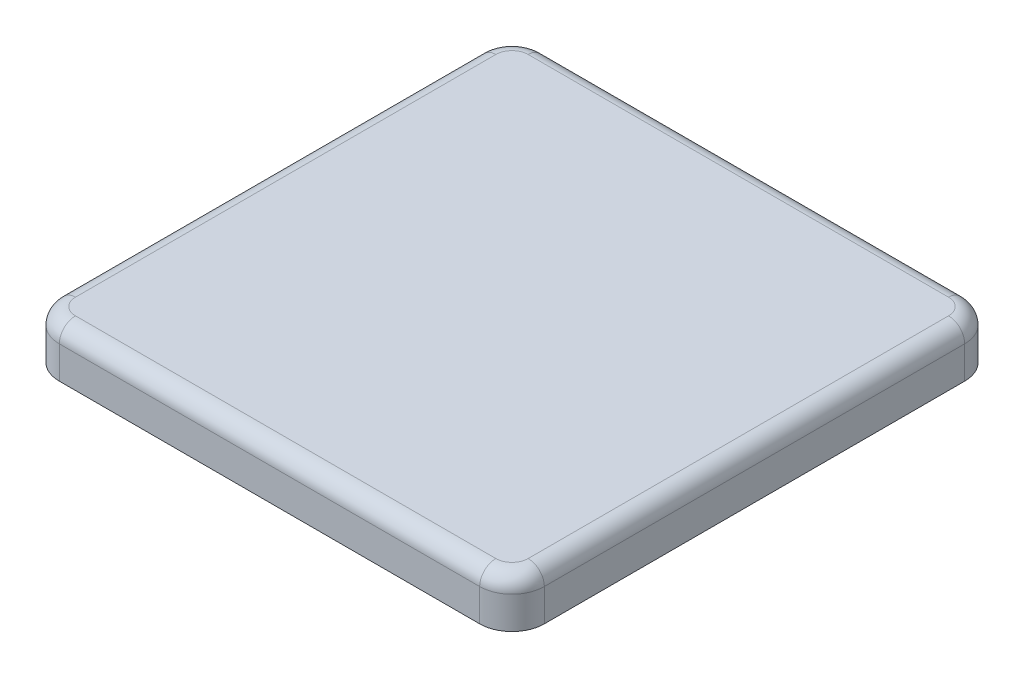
SolidWorks part; units mm, degrees
ref_plane "正面" through (0, 0, 0) normal (0, 0, 1) x (1, 0, 0)
ref_plane "平面" through (0, 0, 0) normal (0, 1, 0) x (1, 0, 0)
ref_plane "右側面" through (0, 0, 0) normal (1, 0, 0) x (0, 0, -1)
sketch "ｽｹｯﾁ1" plane through (0, 0, 0) normal (0, 1, 0) x (0, 0, -1)
  line L1 (-13, 15) -> (13, 15)
  line L2 (-15, 13) -> (-15, -13)
  line L3 (-13, -15) -> (13, -15)
  line L4 (15, 13) -> (15, -13)
  arc A0 (15, 13) -> (13, 15) centre (13, 13) ccw
  arc A1 (13, -15) -> (15, -13) centre (13, -13) ccw
  arc A2 (-15, -13) -> (-13, -15) centre (-13, -13) ccw
  arc A3 (-13, 15) -> (-15, 13) centre (-13, 13) ccw
  point P7 (15, 15)
  point P10 (15, -15)
  point P15 (-15, 15)
  dimension "D5" = 2
  dimension "D1" = 15
  dimension "D2" = 30
  dimension "D3" = 15
  dimension "D4" = 30
extrude "押し出し1" add sketch "ｽｹｯﾁ1" along normal mid plane 3
fillet "ﾌｨﾚｯﾄ1" radius 1 8 edges at (-14.4142, 1.5, 14.4142) (-15, 1.5, 0) (-14.4142, 1.5, -14.4142) (0, 1.5, -15) (14.4142, 1.5, -14.4142) (15, 1.5, 0) (14.4142, 1.5, 14.4142) (0, 1.5, 15)
sketch "ｽｹｯﾁ2" plane through (0, -1.5, 0) normal (0, -1, 0) x (1, 0, 0)
  line L1 (-13, 13.2) -> (13, 13.2)
  line L2 (-13.2, 13) -> (-13.2, -13)
  line L3 (-13, -13.2) -> (13, -13.2)
  line L4 (13.2, 13) -> (13.2, -13)
  arc A0 (-13, 13.2) -> (-13.2, 13) centre (-13, 13) ccw
  arc A1 (13.2, 13) -> (13, 13.2) centre (13, 13) ccw
  arc A2 (13, -13.2) -> (13.2, -13) centre (13, -13) ccw
  arc A3 (-13.2, -13) -> (-13, -13.2) centre (-13, -13) ccw
  point P7 (-13.2, 13.2)
  point P10 (13.2, 13.2)
  point P13 (13.2, -13.2)
  dimension "D5" = 0.2
  dimension "D1" = 13.2
  dimension "D2" = 26.4
  dimension "D3" = 13.2
  dimension "D4" = 26.4
extrude "押し出し2" cut sketch "ｽｹｯﾁ2" against normal blind 1
sketch "ｽｹｯﾁ3" plane through (0, -0.5, 0) normal (0, -1, 0) x (1, 0, 0)
  line L0 (-13.2, 13) -> (-13.2, -13) construction
  line L1 (-13.7, 3) -> (-12.1, 3)
  line L2 (-13.7, 3) -> (-13.7, -3)
  line L3 (-13.7, -3) -> (-12.1, -3)
  line L4 (-12.1, 3) -> (-12.1, -3)
  line L5 (13, -15) -> (-13, -15) construction
  dimension "D1" = 6
  dimension "D2" = 1.6
  dimension "D3" = 1.1
  dimension "D4" = 12
extrude "押し出し3" add sketch "ｽｹｯﾁ3" along normal blind 2.5
sketch "ｽｹｯﾁ4" plane through (0, -0.5, 0) normal (0, -1, 0) x (1, 0, 0)
  line L1 (-1.65, 2.45) -> (1.65, 2.45)
  line L2 (-1.65, 2.45) -> (-1.65, -2.45)
  line L3 (-1.65, -2.45) -> (1.65, -2.45)
  line L4 (1.65, 2.45) -> (1.65, -2.45)
  dimension "D1" = 3.3
  dimension "D2" = 4.9
  dimension "D3" = 1.65
  dimension "D4" = 2.45
extrude "押し出し4" add sketch "ｽｹｯﾁ4" along normal blind 8 draft 0.5
fillet "ﾌｨﾚｯﾄ2" radius 0.8 4 edges at (0, -8.5, 2.3802) (1.5802, -8.5, 0) (0, -8.5, -2.3802) (-1.5802, -8.5, 0)
